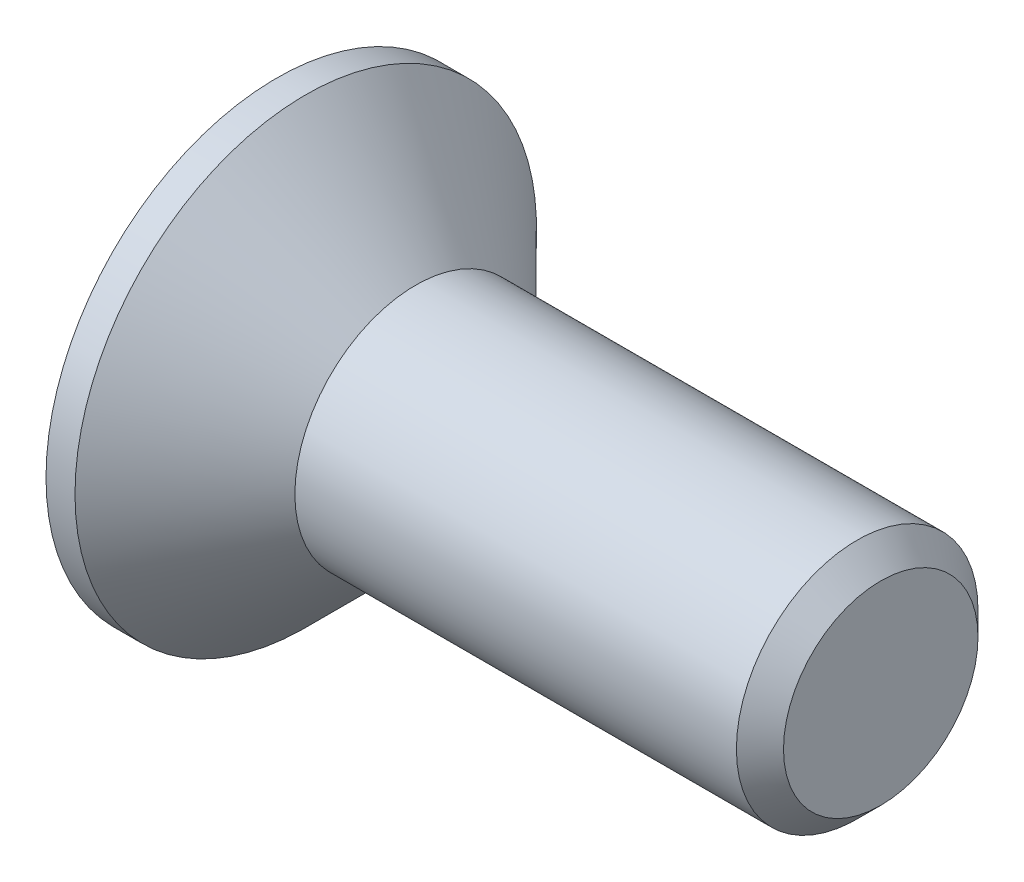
SolidWorks part; units mm, degrees
ref_plane "Plane1" through (0, 0, 0) normal (0, 0, 1) x (1, 0, 0)
ref_plane "Plane2" through (0, 0, 0) normal (0, 1, 0) x (1, 0, 0)
ref_plane "Plane3" through (0, 0, 0) normal (1, 0, 0) x (0, 0, -1)
other "PropertyManager"
sketch "BodySke" plane through (0, 0, 0) normal (0, 0, 1) x (1, 0, 0)
  line L0 (0, 0) -> (0, 3.82)
  line L1 (0.48, 3.82) -> (2.3, 2)
  line L2 (0, 3.82) -> (0.48, 3.82)
  line L3 (2.3, 2) -> (9.61, 2)
  line L4 (10, 1.61) -> (10, 0)
  line L5 (10, 0) -> (0, 0)
  line L6 (0, 0) -> (127, 0) construction
  line L7 (0.48, -3.82) -> (2.3, -2) construction
  line L8 (10, 1.61) -> (9.61, 2)
  line L9 (0, -3.82) -> (0.48, -3.82) construction
  line L10 (10, -1.61) -> (9.61, -2) construction
  line L11 (3, 8.35) -> (3, -13.875) construction
  line L12 (0, 16.35) -> (0, -5.875) construction
  dimension "Diameter" = 4
  dimension "Head_ht" = 2.3
  dimension "Length" = 10
  dimension "Body_ch_ang" = 45
  dimension "Head_dia" = 7.64
  dimension "Minor_dia" = 3.22
  dimension "Head_ang" = 90
  dimension "Advance" = 0.7
  dimension "Thread_nom" = 10
revolve "BaseBody" add sketch "BodySke" angle 360 about L6
sketch "Sketch3" plane through (0, 0, 0) normal (-1, 0, 0) x (0, 0, 1)
  line L0 (-1.26, -0.7275) -> (-1.26, 0.7275)
  line L1 (-1.26, 0.7275) -> (0, 1.4549)
  line L2 (0, 1.4549) -> (1.26, 0.7275)
  line L3 (1.26, 0.7275) -> (1.26, -0.7275)
  line L4 (1.26, -0.7275) -> (0, -1.4549)
  line L5 (0, -1.4549) -> (-1.26, -0.7275)
  circle A1 centre (0, 0) radius 3.82 construction
  dimension "D1" = 1.26
  dimension "D2" = 1.26
  dimension "D3" = 2.52
  dimension "Hex_size" = 2.52
extrude "Hex" cut sketch "Sketch3" against normal blind 1.8
equation "\"D1@Sketch3\" = \"Hex_size@Sketch3\" / 2"
equation "\"D2@Sketch3\" = \"D1@Sketch3\""
equation "\"D3@Sketch3\" = \"Hex_size@Sketch3\""
